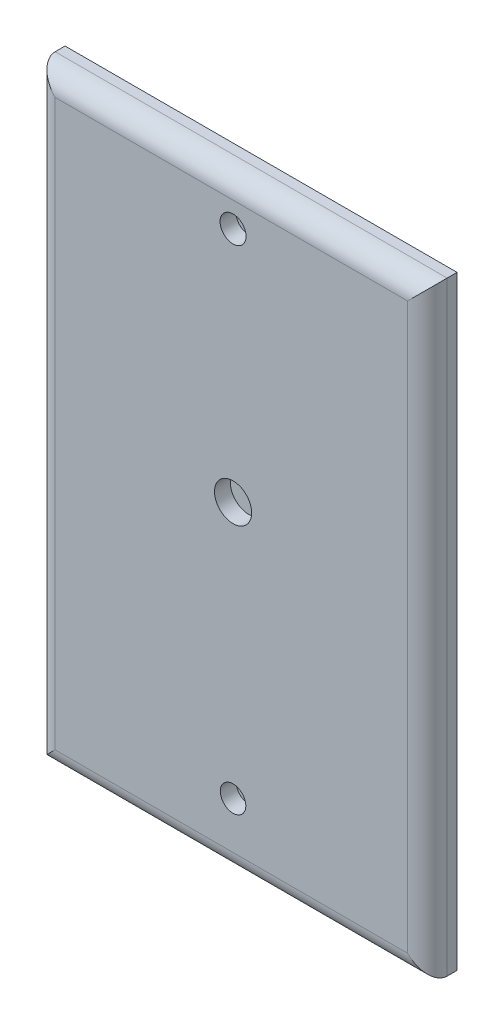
SolidWorks part; units mm, degrees
ref_plane "Front Plane" through (0, 0, 0) normal (0, 0, 1) x (1, 0, 0)
ref_plane "Top Plane" through (0, 0, 0) normal (0, 1, 0) x (1, 0, 0)
ref_plane "Right Plane" through (0, 0, 0) normal (1, 0, 0) x (0, 0, -1)
sketch "Sketch1" plane through (0, 0, 0) normal (0, 0, 1) x (1, 0, 0)
  line L0 (-114.429, -165.8718) -> (86.8035, 144.4404) construction
  line L1 (-114.429, 144.4404) -> (86.8035, 144.4404)
  line L2 (-114.429, 144.4404) -> (-114.429, -165.8718)
  line L3 (-114.429, -165.8718) -> (86.8035, -165.8718)
  line L4 (86.8035, 144.4404) -> (86.8035, -165.8718)
  point P4 (0, 0)
  point P5 (-5.1127, -100.8015)
  point P7 (52.1004, -6.1601)
  dimension "D1" = 52.1004
  dimension "D2" = 86.8035
  dimension "D3" = 5.1127
  dimension "D4" = 114.429
  dimension "D5" = 144.4404
  dimension "D6" = 6.1601
  dimension "D7" = 100.8015
  dimension "D8" = 165.8718
extrude "Extrude1" add sketch "Sketch1" along normal blind 15.24
sketch "Sketch2" plane through (0, 0, 15.24) normal (0, 0, 1) x (1, 0, 0)
  line L0 (-114.429, 144.4404) -> (-114.429, -165.8718) construction
  line L1 (-114.429, -165.8718) -> (86.8035, -165.8718) construction
  circle A0 centre (-12.9354, 121.4837) radius 6.6727
  circle A1 centre (-12.9354, -131.7106) radius 6.5488
  circle A2 centre (-12.9354, 0) radius 9.525
  dimension "D1" = 13.3454
  dimension "D2" = 19.05
  dimension "D3" = 13.0977
  dimension "D4" = 101.4936
  dimension "D5" = 34.1611
  dimension "D6" = 165.8718
  dimension "D7" = 287.3555
extrude "Cut-Extrude1" cut sketch "Sketch2" against normal blind 8.128
fillet "Fillet1" radius 10.16 4 edges at (-114.429, -10.7157, 15.24) (-13.8128, -165.8718, 15.24) (86.8035, -10.7157, 15.24) (-13.8128, 144.4404, 15.24)
